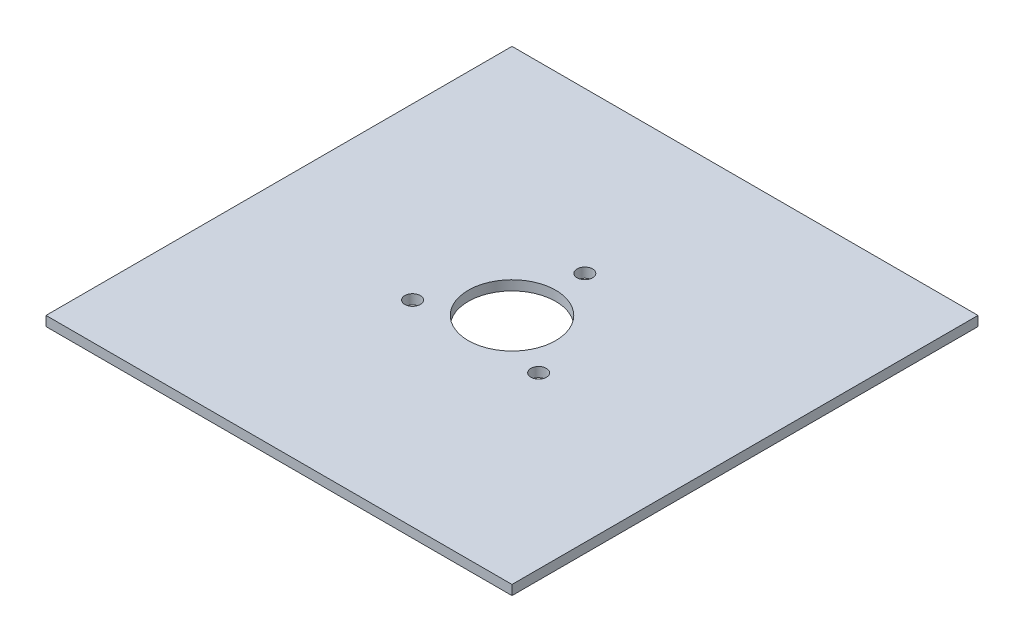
SolidWorks part; units mm, degrees
ref_plane "Front Plane" through (0, 0, 0) normal (0, 0, 1) x (1, 0, 0)
ref_plane "Top Plane" through (0, 0, 0) normal (0, 1, 0) x (1, 0, 0)
ref_plane "Right Plane" through (0, 0, 0) normal (1, 0, 0) x (0, 0, -1)
sketch "Sketch1" plane through (0, 0, 0) normal (0, 1, 0) x (1, 0, 0)
  line L1 (-76.2, -76.2) -> (76.2, -76.2)
  line L2 (-76.2, -76.2) -> (-76.2, 76.2)
  line L3 (-76.2, 76.2) -> (76.2, 76.2)
  line L4 (76.2, -76.2) -> (76.2, 76.2)
  line L5 (-76.2, -76.2) -> (76.2, 76.2) construction
  line L6 (-76.2, 76.2) -> (76.2, -76.2) construction
  point P0 (0, 0)
  dimension "D1" = 152.4
  dimension "D2" = 152.4
extrude "Boss-Extrude1" add sketch "Sketch1" along normal mid plane 3.175
sketch "Sketch2" plane through (0, 1.5875, 0) normal (0, 1, 0) x (1, 0, 0)
  circle A0 centre (0, 0) radius 14.2875
  circle A1 centre (0, 23.8125) radius 2.54
  circle A2 centre (20.6222, -11.9062) radius 2.54
  circle A3 centre (-20.6222, -11.9063) radius 2.54
  dimension "D1" = 28.575
  dimension "D2" = 5.08
  dimension "D4" = 23.8125
  dimension "D3" = 3
extrude "Cut-Extrude1" cut sketch "Sketch2" against normal through all
